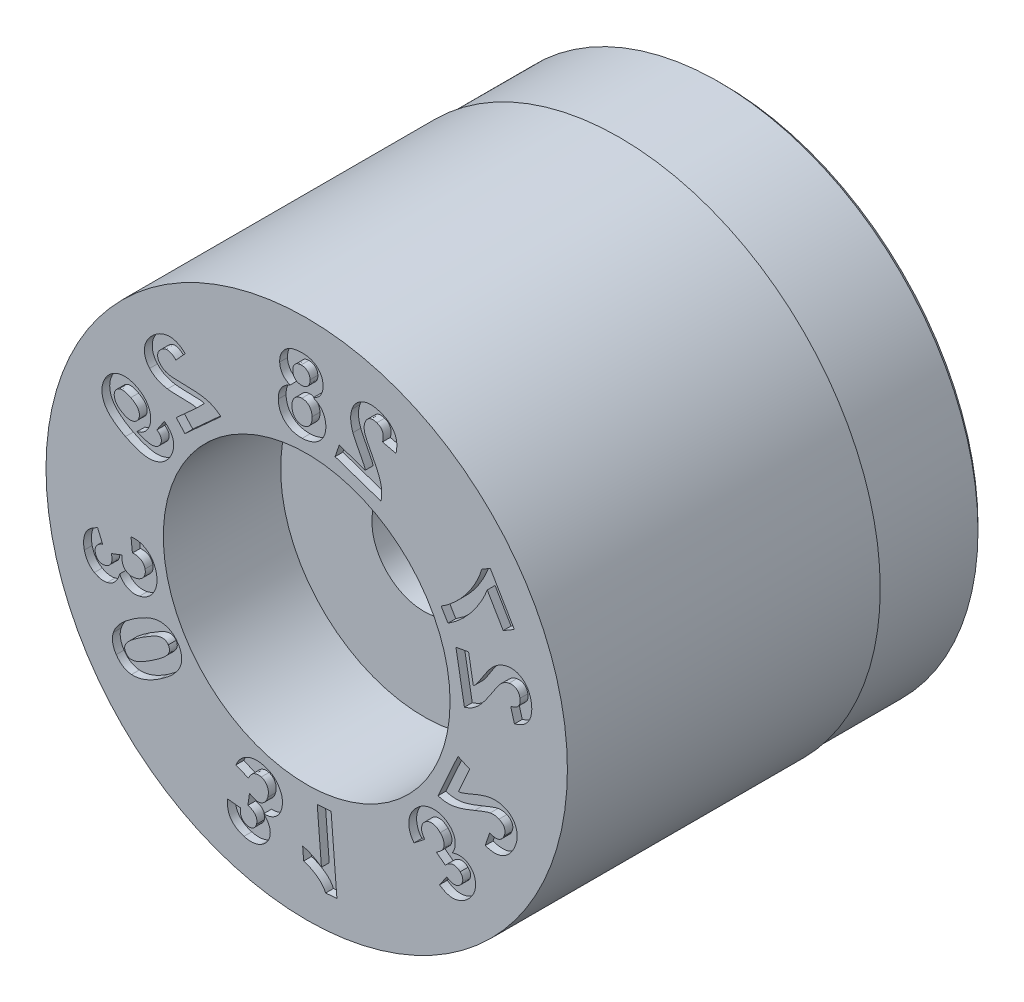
SolidWorks part; units mm, degrees
ref_plane "Front Plane" through (0, 0, 0) normal (0, 0, 1) x (1, 0, 0)
ref_plane "Top Plane" through (0, 0, 0) normal (0, 1, 0) x (1, 0, 0)
ref_plane "Right Plane" through (0, 0, 0) normal (1, 0, 0) x (0, 0, -1)
sketch "Sketch1" plane through (0, 0, 0) normal (1, 0, 0) x (0, 0, -1)
  line L2 (0, 10) -> (0, 5.5)
  line L3 (15.75, 10) -> (0, 10)
  line L4 (-3.7979, 0) -> (49996.2021, 0) construction
  line L8 (16, 2) -> (4.5, 2)
  line L9 (4.5, 5.5) -> (4.5, 2)
  line L10 (4.5, 5.5) -> (0, 5.5)
  line L12 (16, 2) -> (16, 9.75)
  line L16 (16, 9.75) -> (15.75, 10)
  dimension "D1" = 16
  dimension "D2" = 45
  dimension "D3" = 0.25
  dimension "D4" = 20
  dimension "D5" = 11
  dimension "D6" = 4.5
  dimension "D7" = 4
revolve "Revolve1" add sketch "Sketch1" angle 360 about L4
sketch "Sketch4" plane through (0, 0, 0) normal (1, 0, 0) x (0, 0, -1)
  line L0 (0, 0) -> (50000, 0) construction
  line L1 (16, -9.75) -> (16, 9.75) construction
  line L2 (12, 10.935) -> (16, 10.935)
  line L3 (12, 10.935) -> (12, 9.935)
  line L4 (12, 9.935) -> (16, 9.935)
  line L5 (16, 10.935) -> (16, 9.935)
  line L6 (15.75, 10) -> (0, 10) construction
  line L9 (0, 11) -> (0, -11) construction
  dimension "D1" = 1
  dimension "D2" = 0.065
  dimension "D3" = 12
revolve "Cut-Revolve1" cut sketch "Sketch4" angle 360 about L0
sketch "Sketch6" plane through (0, 0, 0) normal (0, 0, 1) x (1, 0, 0)
  circle A0 centre (0, 0) radius 6.0672 construction
  text T0 "27  28  29  30  31  32" font "Arial" height 2.8
extrude "Cut-Extrude1" cut sketch "Sketch6" against normal blind 0.3
